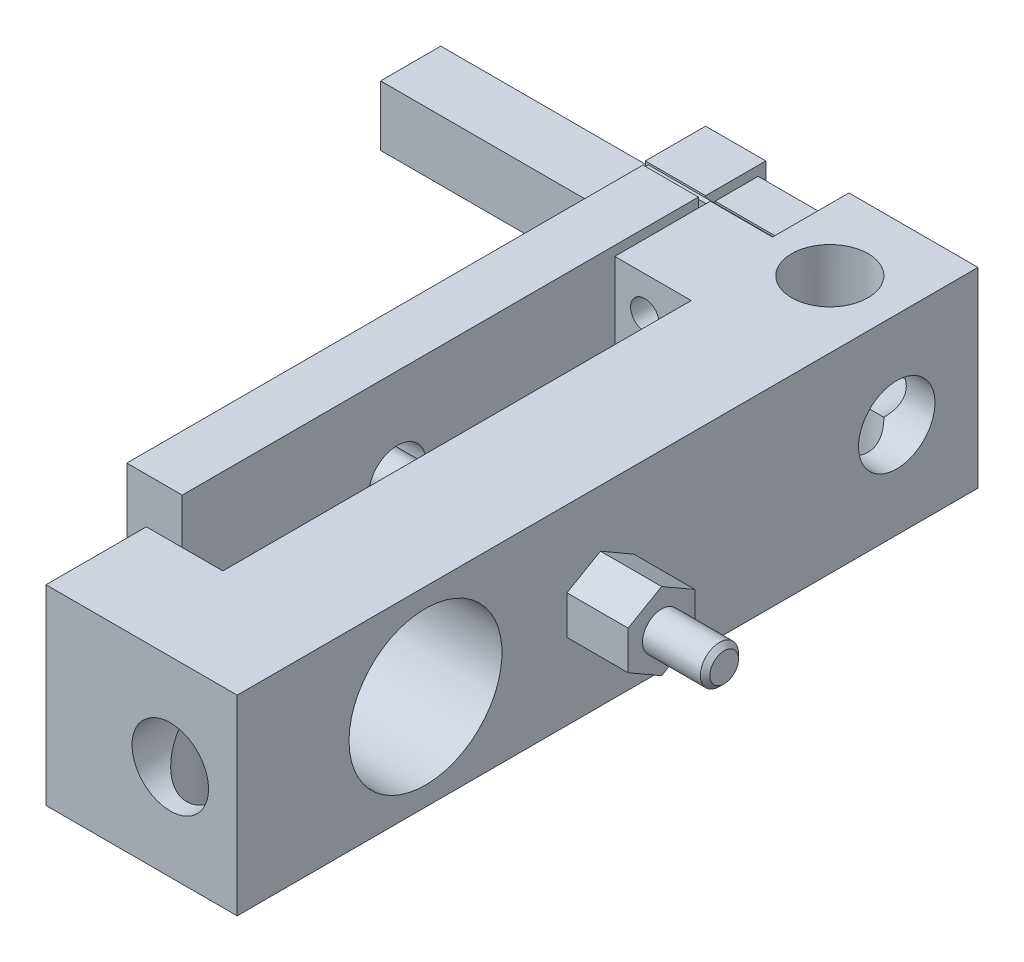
SolidWorks part; units mm, degrees
ref_plane "Plan1" through (0, 0, 0) normal (0, 0, 1) x (1, 0, 0)
ref_plane "Plan2" through (0, 0, 0) normal (0, 1, 0) x (1, 0, 0)
ref_plane "Plan3" through (0, 0, 0) normal (1, 0, 0) x (0, 0, -1)
imported_body "Importée1"
sketch "Esquisse1" plane through (0, 0, 0) normal (0, 1, 0) x (1, 0, 0)
  line L1 (425.6627, 1) -> (455.6627, 1)
  line L2 (425.6627, 1) -> (425.6627, -19)
  line L3 (425.6627, -19) -> (455.6627, -19)
  line L4 (455.6627, 1) -> (455.6627, -19)
  line L7 (489.6627, -7.5) -> (489.6627, -1.2) construction
  dimension "D1" = 34
  dimension "D2" = 30
  dimension "D3" = 20
extrude "Enlèv. mat.-Extru.1" cut sketch "Esquisse1" against normal through all
sketch "Esquisse2" plane through (455.6627, 0, 0) normal (-1, 0, 0) x (0, 0, 1)
  line L0 (4.35, -147.708) -> (10, -147.708) construction
  line L1 (4.35, -147.708) -> (4.35, -151.708) construction
  line L2 (7.5, -144.558) -> (1.2, -144.558) construction
  line L3 (1.2, -150.858) -> (7.5, -150.858) construction
  line L4 (1.2, -150.858) -> (1.2, -144.558) construction
  line L5 (7.5, -150.858) -> (7.5, -144.558) construction
  circle A0 centre (4.35, -147.708) radius 2
  dimension "D1" = 4
extrude "Enlèv. mat.-Extru.2" cut sketch "Esquisse2" against normal blind 6
